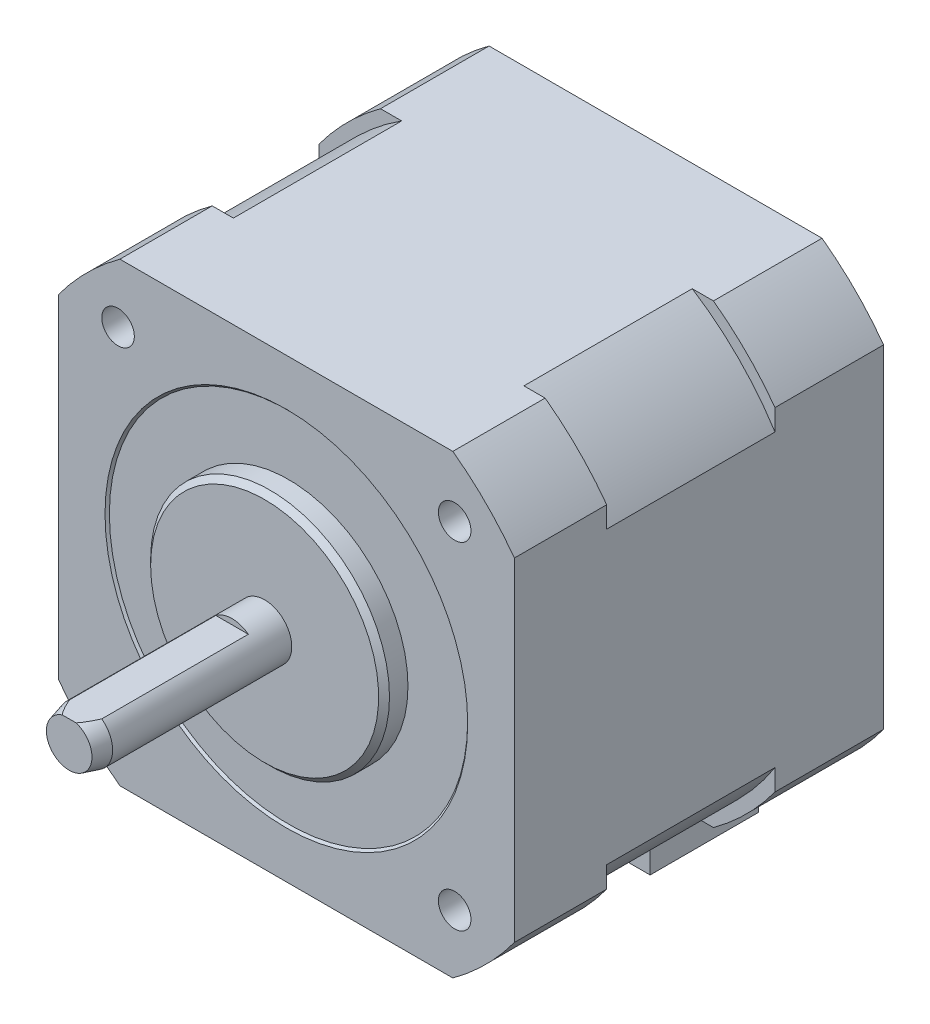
SolidWorks part; units mm, degrees
ref_plane "正面" through (0, 0, 0) normal (0, 0, 1) x (1, 0, 0)
ref_plane "平面" through (0, 0, 0) normal (0, 1, 0) x (1, 0, 0)
ref_plane "右側面" through (0, 0, 0) normal (1, 0, 0) x (0, 0, -1)
sketch "ｽｹｯﾁ1" plane through (0, 0, 0) normal (0, 0, 1) x (1, 0, 0)
  circle A0 centre (0, 0) radius 2.5
  dimension "D1" = 5
extrude "押し出し1" add sketch "ｽｹｯﾁ1" along normal blind 18
sketch "ｽｹｯﾁ2" plane through (0, 0, 0) normal (0, 0, -1) x (-1, 0, 0)
  circle A0 centre (0, 0) radius 11
  dimension "D1" = 22
extrude "押し出し2" add sketch "ｽｹｯﾁ2" along normal blind 2
sketch "ｽｹｯﾁ3" plane through (0, 0, -2) normal (0, 0, -1) x (-1, 0, 0)
  line L1 (-21, 21) -> (21, 21)
  line L2 (-21, 21) -> (-21, -21)
  line L3 (-21, -21) -> (21, -21)
  line L4 (21, 21) -> (21, -21)
  line L5 (-21, 21) -> (21, -21) construction
  line L6 (-21, -21) -> (21, 21) construction
  point P0 (0, 0)
  point P6 (0, 0)
  dimension "D1" = 42
  dimension "D2" = 42
extrude "押し出し3" add sketch "ｽｹｯﾁ3" along normal blind 8.5
sketch "Sketch8" plane through (0, 0, -2) normal (0, 0, 1) x (1, 0, 0)
  circle A0 centre (0, 0) radius 26
  dimension "D1" = 52
extrude "Extrude8" cut sketch "Sketch8" against normal blind 34 flip side to cut
sketch "Sketch16" plane through (0, 0, -2) normal (0, 0, 1) x (1, 0, 0)
  circle A0 centre (-15.5, 15.5) radius 1.5
  circle A1 centre (15.5, 15.5) radius 1.5
  circle A2 centre (15.5, -15.5) radius 1.5
  circle A3 centre (-15.5, -15.5) radius 1.5
  dimension "D1" = 3
  dimension "D2" = 3
  dimension "D3" = 3
  dimension "D4" = 3
  dimension "D5" = 15.5
  dimension "D6" = 31
  dimension "D7" = 15.5
  dimension "D8" = 31
  dimension "D9" = 15.5
  dimension "D10" = 31
  dimension "D11" = 15.5
  dimension "D12" = 31
extrude "Extrude15" cut sketch "Sketch16" against normal blind 4.5
sketch "Sketch9" plane through (0, 0, -10.5) normal (0, 0, -1) x (-1, 0, 0)
  line L4 (-21, 15.3297) -> (-21, -15.3297) construction
  line L5 (-15.3297, -21) -> (15.3297, -21) construction
  line L6 (21, -15.3297) -> (21, 15.3297) construction
  line L7 (15.3297, 21) -> (-15.3297, 21) construction
  line L8 (-21, 13.3795) -> (-21, -13.3795)
  line L9 (-13.3795, -21) -> (13.3795, -21)
  line L10 (21, -13.3795) -> (21, 13.3795)
  line L11 (13.3795, 21) -> (-13.3795, 21)
  arc A1 (21, 13.3795) -> (13.3795, 21) centre (0, 0) ccw
  arc A2 (-13.3795, 21) -> (-21, 13.3795) centre (0, 0) ccw
  arc A3 (-21, -13.3795) -> (-13.3795, -21) centre (0, 0) ccw
  arc A4 (13.3795, -21) -> (21, -13.3795) centre (0, 0) ccw
  dimension "D1" = 49.8
extrude "Extrude9" add sketch "Sketch9" along normal blind 15.5
sketch "Sketch11" plane through (0, 0, -26) normal (0, 0, -1) x (-1, 0, 0)
  line L0 (-21, 13.3795) -> (-21, -13.3795) construction
  line L1 (-21, 15.3297) -> (-21, 13.3795) construction
  line L2 (-21, -13.3795) -> (-21, -15.3297) construction
  line L3 (-13.3795, -21) -> (13.3795, -21) construction
  line L4 (-15.3297, -21) -> (-13.3795, -21) construction
  line L5 (13.3795, -21) -> (15.3297, -21) construction
  line L6 (21, -15.3297) -> (21, -13.3795) construction
  line L7 (21, -13.3795) -> (21, 13.3795) construction
  line L8 (21, 13.3795) -> (21, 15.3297) construction
  line L9 (15.3297, 21) -> (13.3795, 21) construction
  line L10 (-13.3795, 21) -> (-15.3297, 21) construction
  line L11 (-21, 13.3795) -> (-21, -13.3795)
  line L12 (-21, 15.3297) -> (-21, 13.3795)
  line L13 (-21, -13.3795) -> (-21, -15.3297)
  line L14 (-13.3795, -21) -> (13.3795, -21)
  line L15 (-15.3297, -21) -> (-13.3795, -21)
  line L16 (13.3795, -21) -> (15.3297, -21)
  line L17 (21, -15.3297) -> (21, -13.3795)
  line L18 (21, -13.3795) -> (21, 13.3795)
  line L19 (21, 13.3795) -> (21, 15.3297)
  line L20 (15.3297, 21) -> (13.3795, 21)
  line L21 (-13.3795, 21) -> (-15.3297, 21)
  line L22 (13.3795, 21) -> (-13.3795, 21) construction
  line L23 (13.3795, 21) -> (-13.3795, 21)
  arc A0 (-15.3297, 21) -> (-21, 15.3297) centre (0, 0) ccw construction
  arc A1 (-21, -15.3297) -> (-15.3297, -21) centre (0, 0) ccw construction
  arc A2 (15.3297, -21) -> (21, -15.3297) centre (0, 0) ccw construction
  arc A3 (21, 15.3297) -> (15.3297, 21) centre (0, 0) ccw construction
  arc A4 (-15.3297, 21) -> (-21, 15.3297) centre (0, 0) ccw
  arc A5 (-21, -15.3297) -> (-15.3297, -21) centre (0, 0) ccw
  arc A6 (15.3297, -21) -> (21, -15.3297) centre (0, 0) ccw
  arc A7 (21, 15.3297) -> (15.3297, 21) centre (0, 0) ccw
extrude "Extrude11" add sketch "Sketch11" along normal blind 10
chamfer "Chamfer5" distance 1.5 angle 15 1 edges at (2.5, 0, 18)
sketch "Sketch2" plane through (0, 0, 18) normal (0, 0, 1) x (1, 0, 0)
  line L1 (-4.7278, 5.1185) -> (3.4221, 5.1185)
  line L2 (-4.7278, 5.1185) -> (-4.7278, 2)
  line L3 (-4.7278, 2) -> (3.4221, 2)
  line L4 (3.4221, 5.1185) -> (3.4221, 2)
  dimension "D1" = 2
extrude "Extrude2" cut sketch "Sketch2" against normal blind 15
sketch "Sketch6" plane through (0, 0, -2) normal (0, 0, 1) x (1, 0, 0)
  circle A0 centre (0, 0) radius 16.5
  circle A1 centre (0, 0) radius 11 construction
  circle A2 centre (0, 0) radius 11
  dimension "D2" = 33
extrude "Extrude6" cut sketch "Sketch6" against normal blind 0.2
chamfer "Chamfer2" distance 0.5 angle 45 1 edges at (-11, 0, 0)
chamfer "Chamfer7" distance 0.2 angle 45 1 edges at (16.5, 0, -2)
sketch "Sketch13" plane through (0, -21, 0) normal (0, -1, 0) x (1, 0, 0)
  line L0 (15.3297, -36) -> (-15.3297, -36) construction
  line L1 (-9.5, -26) -> (9.5, -26)
  line L2 (-9.5, -26) -> (-9.5, -36)
  line L3 (-9.5, -36) -> (9.5, -36)
  line L4 (9.5, -26) -> (9.5, -36)
  line L5 (-21, -36) -> (-21, -26) construction
  dimension "D1" = 10
  dimension "11.5" = 11.5
  dimension "D2" = 19
extrude "Extrude12" add sketch "Sketch13" along normal blind 6.7
sketch "Sketch14" plane through (0, 0, -36) normal (0, 0, -1) x (-1, 0, 0)
  circle A0 centre (0, 0) radius 2.5
extrude "Extrude13" add sketch "Sketch14" along normal blind 15
chamfer "Chamfer8" distance 1.5 angle 15 1 edges at (-2.5, 0, -51)
sketch "Sketch15" plane through (0, 0, -51) normal (0, 0, -1) x (-1, 0, 0)
  line L0 (0, 0) -> (-7.0229, 0) construction
  line L1 (-5, 4) -> (5, 4)
  line L2 (-5, 4) -> (-5, 2)
  line L3 (-5, 2) -> (5, 2)
  line L4 (5, 4) -> (5, 2)
  line L5 (0, 0) -> (0, 9.1437) construction
  dimension "D1" = 10
  dimension "D2" = 2
  dimension "D3" = 5
  dimension "D4" = 2
extrude "Extrude14" cut sketch "Sketch15" against normal blind 15
